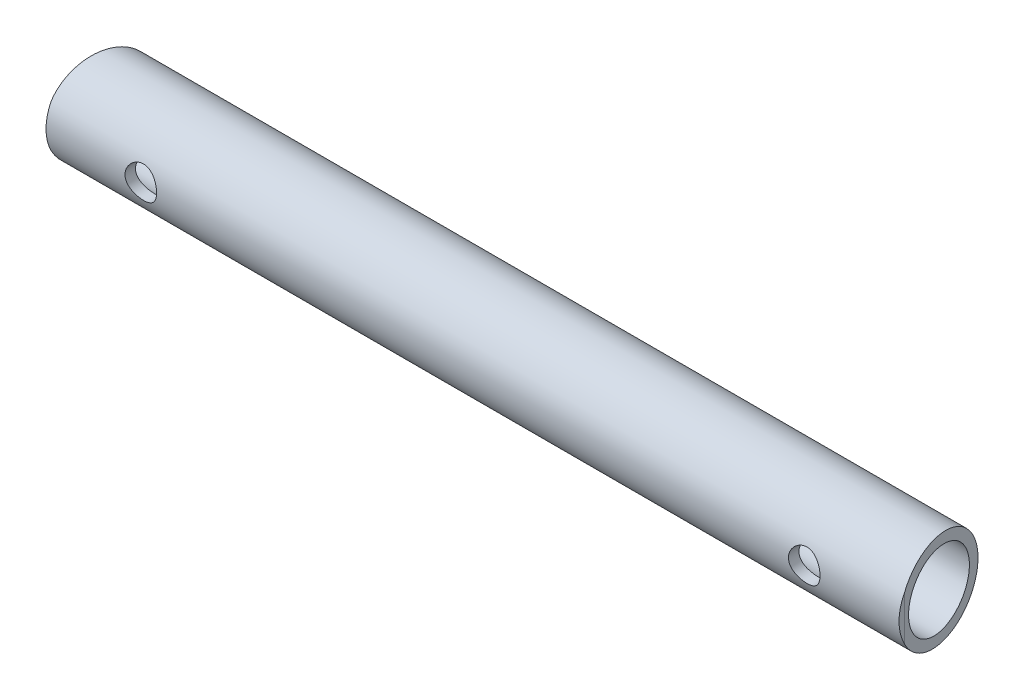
SolidWorks part; units mm, degrees
ref_plane "Front Plane" through (0, 0, 0) normal (0, 0, 1) x (1, 0, 0)
ref_plane "Top Plane" through (0, 0, 0) normal (0, 1, 0) x (1, 0, 0)
ref_plane "Right Plane" through (0, 0, 0) normal (1, 0, 0) x (0, 0, -1)
sketch "Sketch1" plane through (0, 0, 0) normal (0, 0, 1) x (1, 0, 0)
  line L0 (0, 0) -> (58.8665, 0) construction
  line L1 (-85.725, 7.4168) -> (85.725, 7.4168)
  line L2 (85.725, 7.4168) -> (85.725, 9.525)
  line L3 (85.725, 9.525) -> (-85.725, 9.525)
  line L4 (-85.725, 9.525) -> (-85.725, 7.4168)
  line L5 (0, 0) -> (0, 17.8754) construction
  line L6 (-66.675, 0) -> (-66.675, 9.525)
  line L7 (66.675, 0) -> (66.675, 9.525)
  circle A2 centre (-66.675, 0) radius 3.175
  circle A3 centre (66.675, 0) radius 3.175
  dimension "D4" = 19.05
  dimension "D5" = 6.35
  dimension "D1" = 2.1082
  dimension "D2" = 19.05
  dimension "D3" = 171.45
sketch "Sketch2" plane through (0, 0, 0) normal (0, 0, 1) x (1, 0, 0)
  line L0 (-85.725, 7.4168) -> (85.725, 7.4168) construction
  line L1 (85.725, 7.4168) -> (85.725, 9.525) construction
  line L2 (85.725, 9.525) -> (-85.725, 9.525) construction
  line L3 (-85.725, 9.525) -> (-85.725, 7.4168) construction
  line L4 (-85.725, 7.4168) -> (85.725, 7.4168)
  line L5 (85.725, 7.4168) -> (85.725, 9.525)
  line L6 (85.725, 9.525) -> (-85.725, 9.525)
  line L7 (-85.725, 9.525) -> (-85.725, 7.4168)
revolve "Revolve1" add sketch "Sketch2" angle 360 about L0
sketch "Sketch4" plane through (0, 0, 0) normal (0, 1, 0) x (1, 0, 0)
  line L0 (0, 0) -> (-84.2342, 0) construction
  line L1 (-80.6512, 20.32) -> (-84.2342, 0)
  line L2 (0, 0) -> (84.2342, 0) construction
  line L3 (84.2342, 0) -> (80.6512, 20.32)
  line L4 (0, 0) -> (0, 27.8715) construction
  line L5 (-84.2342, 0) -> (-88.265, -22.86)
  line L6 (84.2342, 0) -> (88.265, -22.86)
  line L7 (-88.265, -22.86) -> (-88.265, 20.32)
  line L8 (-88.265, 20.32) -> (-80.6512, 20.32)
  line L9 (80.6512, 20.32) -> (88.265, 20.32)
  line L10 (88.265, 20.32) -> (88.265, -22.86)
  line L11 (-85.725, 9.525) -> (-85.725, -9.525) construction
  dimension "D1" = 80
  dimension "D2" = 2.54
  dimension "D3" = 20.32
  dimension "D4" = 43.18
extrude "Cut-Extrude5" cut sketch "Sketch4" against normal mid plane 50.8
sketch "Sketch5" plane through (0, 0, 0) normal (0, 0, 1) x (1, 0, 0)
  circle A0 centre (-66.675, 0) radius 3.175 construction
  circle A1 centre (66.675, 0) radius 3.175 construction
  circle A2 centre (-66.675, 0) radius 3.175
  circle A3 centre (66.675, 0) radius 3.175
extrude "Cut-Extrude6" cut sketch "Sketch5" against normal mid plane 50.8
